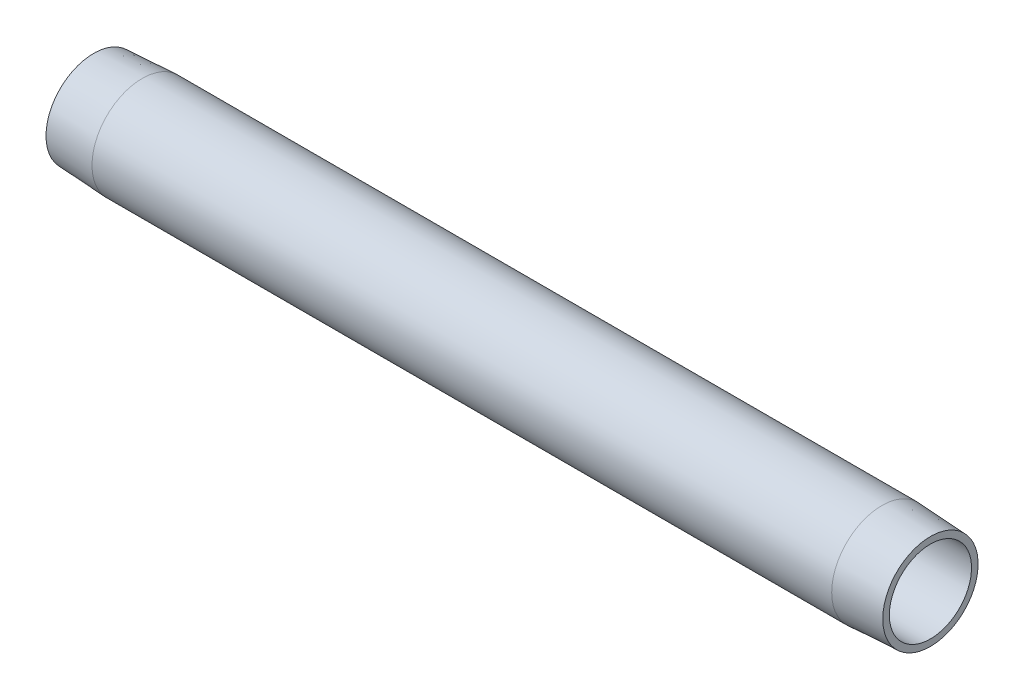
SolidWorks part; units mm, degrees
ref_plane "Front Plane" through (0, 0, 0) normal (0, 0, 1) x (1, 0, 0)
ref_plane "Top Plane" through (0, 0, 0) normal (0, 1, 0) x (1, 0, 0)
ref_plane "Right Plane" through (0, 0, 0) normal (1, 0, 0) x (0, 0, -1)
sketch "Sketch1" plane through (0, 0, 0) normal (0, 0, 1) x (1, 0, 0)
  line L6 (177.8, 8.7313) -> (0, 8.7313)
  line L7 (10.3124, 10.668) -> (0, 10.1276)
  line L8 (167.4876, 10.668) -> (10.3124, 10.668)
  line L9 (177.8, 10.1276) -> (167.4876, 10.668)
  line L10 (177.8, 8.7313) -> (177.8, 10.1276)
  line L11 (0, 10.1276) -> (0, 8.7313)
  line L12 (0, 0) -> (50000, 0) construction
  line L13 (0, -55) -> (0, 55) construction
  dimension "D1" = 177.8
  dimension "D2" = 3
  dimension "D3" = 3
  dimension "D4" = 21.336
  dimension "D5" = 17.4625
  dimension "D6" = 10.3124
  dimension "D7" = 10.3124
revolve "Revolve1" add sketch "Sketch1" angle 360 about L12
